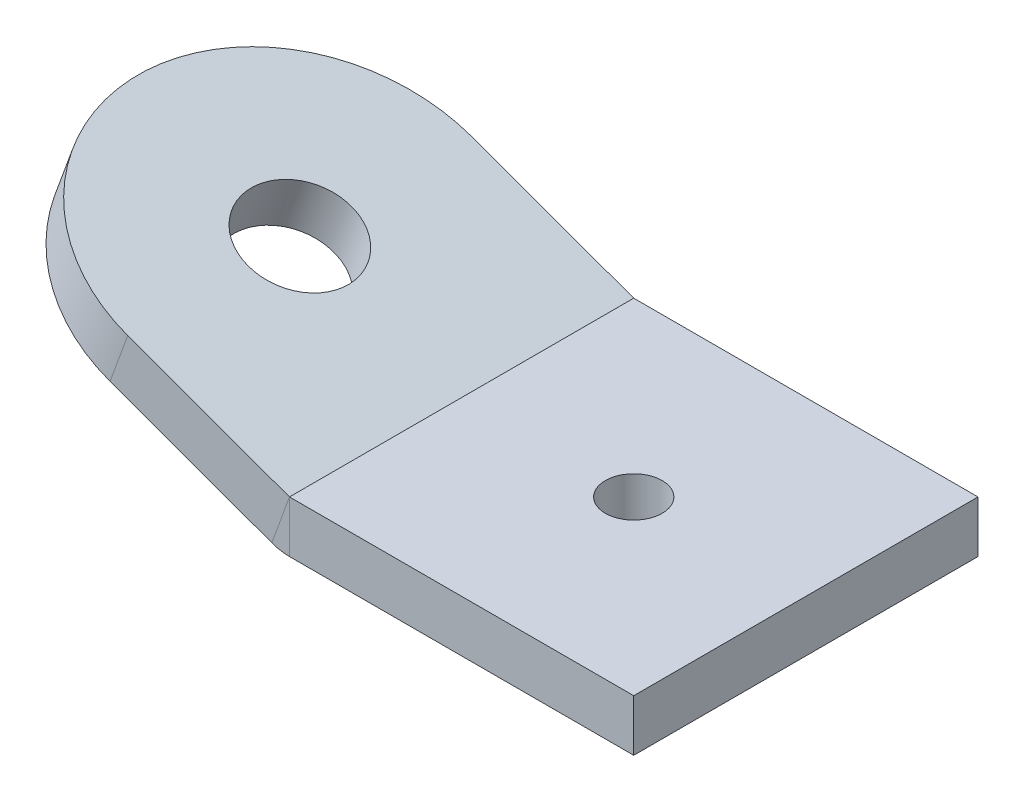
SolidWorks part; units mm, degrees
ref_plane "Front Plane" through (0, 0, 0) normal (0, 0, 1) x (1, 0, 0)
ref_plane "Top Plane" through (0, 0, 0) normal (0, 1, 0) x (1, 0, 0)
ref_plane "Right Plane" through (0, 0, 0) normal (1, 0, 0) x (0, 0, -1)
sketch "Sketch1" plane through (0, 0, 0) normal (0, 1, 0) x (1, 0, 0)
  line L0 (0, 0) -> (30, 0) construction
  line L1 (0, 10) -> (30, 10)
  line L2 (30, 10) -> (30, -10)
  line L3 (30, -10) -> (0, -10)
  circle A0 centre (0, 0) radius 3
  arc A1 (0, 10) -> (0, -10) centre (0, 0) ccw
  dimension "D1" = 6
  dimension "D2" = 20
  dimension "D3" = 30
sheet metal parameters "Sheet-Metal1" thickness 3 parameters "D1"=0.0001
base flange "Base-Flange1" sketch "Sketch1" thickness 3 reverse thickness direction yes parameters "D1"=0.0001
sketch "Sketch3" plane through (0, 3, 0) normal (0, 1, 0) x (1, 0, 0)
  line L0 (0, 0) -> (30, 0) construction
  line L1 (30, -10) -> (30, 10) construction
  point P5 (20, 0)
  dimension "D1" = 10
hole_wizard "M4 Tapped Hole1" positions "3DSketch1" profile "Sketch4" tap size "M4" standard "ISO"
sketch3d "3DSketch1"
  point P0 (20, 3, 0)
sketch "Sketch4" plane through (20, 3, 0) normal (1, 0, 0) x (0, 0, 1)
  line L0 (0, 0) -> (0, 3)
  line L1 (0, 3) -> (1.65, 3)
  line L2 (1.65, 3) -> (1.65, 0)
  line L5 (1.65, 0) -> (0, 0)
  line L11 (0, -6.35) -> (0, 107.95) construction
  dimension "Thru Tap Drill Dia." = 3.3
  dimension "Thru Tap Drill Depth" = 3
sketch "Sketch5" plane through (0, 3, 0) normal (0, 1, 0) x (1, 0, 0)
  line L0 (10, -10) -> (10, 10)
  line L1 (0, -10) -> (30, -10) construction
  line L2 (30, 10) -> (0, 10) construction
  line L3 (30, -10) -> (30, 10) construction
  dimension "D1" = 20
sketched bend "Sketched Bend2" parameters "D1"=0.001
bend "SketchBend2" bend radius 0.001 bend angle 20 parameters "D5"=1
flat pattern "Flat-Pattern1"
sketch "Bend-Lines1" plane through (0, 0, 0) normal (0, 1, 0) x (-1, 0, 0)
bend of the flat pattern "Flatten-<SketchBend2>1"
